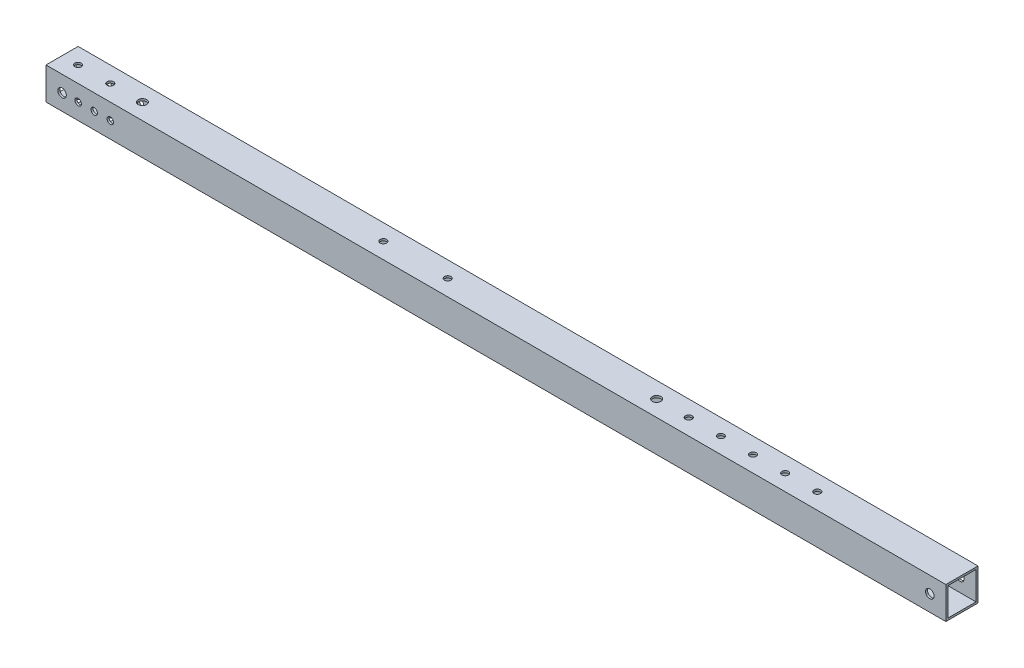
SolidWorks part; units mm, degrees
ref_plane "Front Plane" through (0, 0, 0) normal (0, 0, 1) x (1, 0, 0)
ref_plane "Top Plane" through (0, 0, 0) normal (0, 1, 0) x (1, 0, 0)
ref_plane "Right Plane" through (0, 0, 0) normal (1, 0, 0) x (0, 0, -1)
sketch "Sketch1" plane through (0, 0, 0) normal (1, 0, 0) x (0, 0, -1)
  line L1 (-12.7, -12.7) -> (12.7, -12.7)
  line L2 (-12.7, -12.7) -> (-12.7, 12.7)
  line L3 (-12.7, 12.7) -> (12.7, 12.7)
  line L4 (12.7, -12.7) -> (12.7, 12.7)
  line L5 (-12.7, -12.7) -> (12.7, 12.7) construction
  line L6 (-12.7, 12.7) -> (12.7, -12.7) construction
  line L7 (-11.1125, -11.1125) -> (11.1125, -11.1125)
  line L8 (-11.1125, -11.1125) -> (-11.1125, 11.1125)
  line L9 (-11.1125, 11.1125) -> (11.1125, 11.1125)
  line L10 (11.1125, -11.1125) -> (11.1125, 11.1125)
  line L11 (-11.1125, -11.1125) -> (11.1125, 11.1125) construction
  line L12 (-11.1125, 11.1125) -> (11.1125, -11.1125) construction
  point P0 (0, 0)
  point P6 (0, 0)
  dimension "D1" = 25.4
  dimension "D2" = 1.5875
extrude "Boss-Extrude1" add sketch "Sketch1" along normal blind 711.2
hole_wizard "#7 (0.201) Diameter Hole1" positions "Sketch3" profile "Sketch4" hole size "#7" standard "ANSI Inch"
sketch "Sketch3" plane through (0, 0, 12.7) normal (0, 0, 1) x (1, 0, 0)
  point P0 (12.7, 0)
  point P7 (25.4, 0)
  point P8 (38.1, 0)
  point P9 (50.8, 0)
  dimension "D1" = 12.7
  dimension "D3" = 12.7
  dimension "D2" = 4
sketch "Sketch4" plane through (12.7, 0, 12.7) normal (1, 0, 0) x (0, -1, 0)
  line L0 (0, 0) -> (0, 25.4)
  line L1 (0, 25.4) -> (2.5527, 25.4)
  line L2 (2.5527, 25.4) -> (2.5527, 0)
  line L5 (2.5527, 0) -> (0, 0)
  line L11 (0, -6.35) -> (0, 107.95) construction
  dimension "Thru Hole Dia." = 5.1054
  dimension "Thru Hole Depth" = 25.4
hole_wizard "#7 (0.201) Diameter Hole2" positions "Sketch5" profile "Sketch6" hole size "#7" standard "ANSI Inch"
sketch "Sketch5" plane through (0, 12.7, 0) normal (0, 1, 0) x (1, 0, 0)
  line L0 (0, 12.7) -> (0, -12.7) construction
  line L1 (711.2, 12.7) -> (711.2, -12.7) construction
  point P0 (12.7, 0)
  point P4 (38.1, 0)
  point P12 (596.9, 0)
  point P19 (254, 0)
  point P34 (571.5, 0)
  point P35 (546.1, 0)
  point P36 (520.7, 0)
  point P38 (495.3, 0)
  point P41 (304.8, 0)
  dimension "D1" = 12.7
  dimension "D2" = 25.4
  dimension "D3" = 50.8
  dimension "D4" = 215.9
  dimension "D5" = 114.3
  dimension "D7" = 25.4
  dimension "D6" = 5
sketch "Sketch6" plane through (12.7, 12.7, 0) normal (1, 0, 0) x (0, 0, 1)
  line L0 (0, 0) -> (0, 25.4)
  line L1 (0, 25.4) -> (2.5527, 25.4)
  line L2 (2.5527, 25.4) -> (2.5527, 0)
  line L5 (2.5527, 0) -> (0, 0)
  line L11 (0, -6.35) -> (0, 107.95) construction
  dimension "Thru Hole Dia." = 5.1054
  dimension "Thru Hole Depth" = 25.4
hole_wizard "17/64 (0.26563) Diameter Hole1" positions "Sketch7" profile "Sketch8" hole size "17/64" standard "ANSI Inch"
sketch "Sketch7" plane through (0, 12.7, 0) normal (0, 1, 0) x (1, 0, 0)
  circle A0 centre (38.1, 0) radius 2.5527 construction
  circle A1 centre (38.1, 0) radius 2.5527
  circle A2 centre (520.7, 0) radius 2.5527 construction
  circle A3 centre (520.7, 0) radius 2.5527
  circle A4 centre (495.3, 0) radius 2.5527 construction
  point P0 (469.9, 0)
  point P2 (63.5, 0)
  dimension "D1" = 25.4
  dimension "D2" = 25.4
sketch "Sketch8" plane through (469.9, 12.7, 0) normal (1, 0, 0) x (0, 0, 1)
  line L0 (0, 0) -> (0, 25.4)
  line L1 (0, 25.4) -> (3.3735, 25.4)
  line L2 (3.3735, 25.4) -> (3.3735, 0)
  line L5 (3.3735, 0) -> (0, 0)
  line L11 (0, -6.35) -> (0, 107.95) construction
  dimension "Thru Hole Dia." = 6.747
  dimension "Thru Hole Depth" = 25.4
hole_wizard "17/64 (0.26563) Diameter Hole2" positions "Sketch9" profile "Sketch10" hole size "17/64" standard "ANSI Inch"
sketch "Sketch9" plane through (0, 0, 12.7) normal (0, 0, 1) x (1, 0, 0)
  line L0 (711.2, 12.7) -> (711.2, -12.7) construction
  line L2 (711.2, -12.7) -> (0, -12.7) construction
  point P0 (698.5, 0)
  dimension "D1" = 12.7
  dimension "D2" = 12.7
sketch "Sketch10" plane through (698.5, 0, 12.7) normal (1, 0, 0) x (0, -1, 0)
  line L0 (0, 0) -> (0, 25.4)
  line L1 (0, 25.4) -> (3.3735, 25.4)
  line L2 (3.3735, 25.4) -> (3.3735, 0)
  line L5 (3.3735, 0) -> (0, 0)
  line L11 (0, -6.35) -> (0, 107.95) construction
  dimension "Thru Hole Dia." = 6.747
  dimension "Thru Hole Depth" = 25.4
hole_wizard "17/64 (0.26563) Diameter Hole3" positions "Sketch12" profile "Sketch13" hole size "17/64" standard "ANSI Inch"
sketch "Sketch12" plane through (0, 0, 12.7) normal (0, 0, 1) x (1, 0, 0)
  point P0 (12.7, 0)
sketch "Sketch13" plane through (12.7, 0, 12.7) normal (1, 0, 0) x (0, -1, 0)
  line L0 (0, 0) -> (0, 25.4)
  line L1 (0, 25.4) -> (3.3735, 25.4)
  line L2 (3.3735, 25.4) -> (3.3735, 0)
  line L5 (3.3735, 0) -> (0, 0)
  line L11 (0, -6.35) -> (0, 107.95) construction
  dimension "Thru Hole Dia." = 6.747
  dimension "Thru Hole Depth" = 25.4
